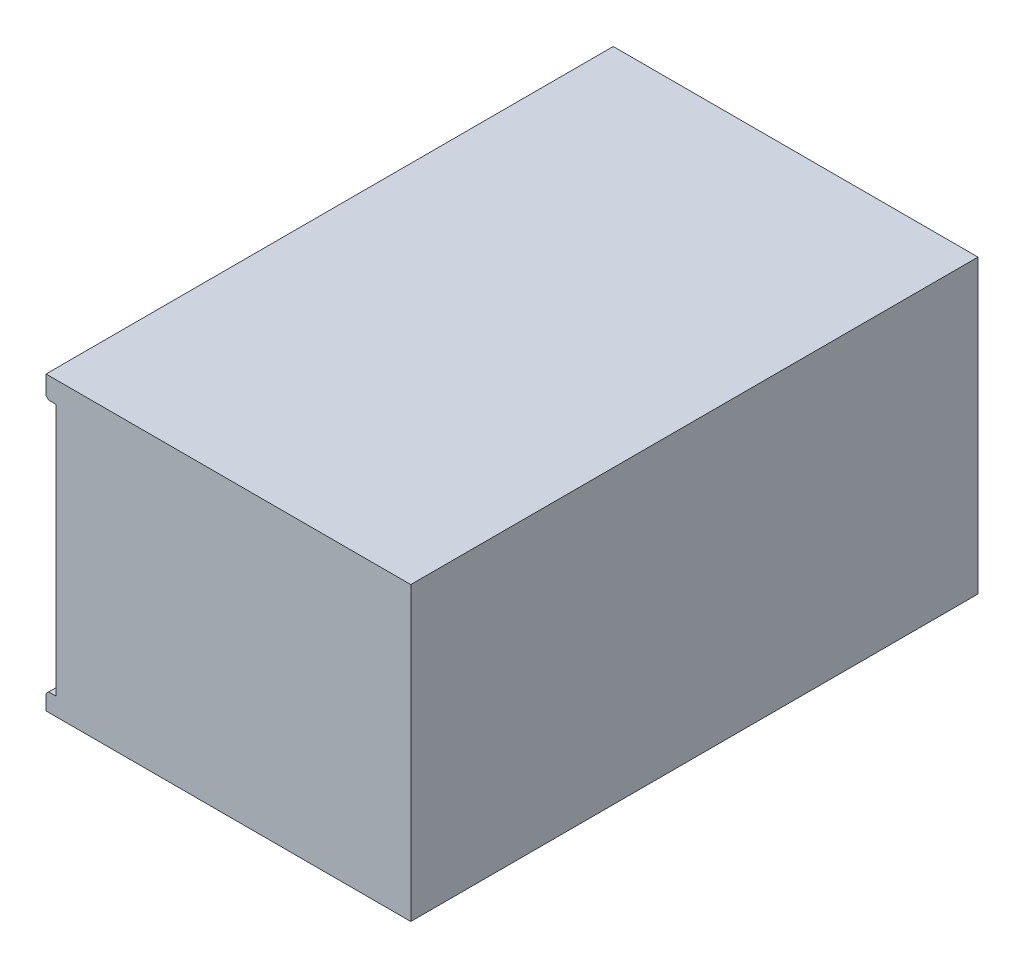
SolidWorks part; units mm, degrees
ref_plane "FRONT" through (0, 0, 0) normal (0, 0, 1) x (1, 0, 0)
ref_plane "TOP" through (0, 0, 0) normal (0, 1, 0) x (1, 0, 0)
ref_plane "RIGHT" through (0, 0, 0) normal (1, 0, 0) x (0, 0, -1)
sketch "Sketch1" plane through (0, 0, 0) normal (0, 0, 1) x (1, 0, 0)
  line L0 (50.673, 0) -> (50.673, -41.656)
  line L1 (50.673, -41.656) -> (-1.397, -41.656)
  line L2 (-1.397, -41.656) -> (-1.397, -39.116)
  line L3 (-1.397, -39.116) -> (0, -39.116)
  line L4 (0, -39.116) -> (0, -3.048)
  line L5 (0, -3.048) -> (-1.397, -3.048)
  line L6 (-1.397, -3.048) -> (-1.397, 0)
  line L7 (-1.397, 0) -> (50.673, 0)
  dimension "D1" = 52.07
  dimension "D2" = 50.673
  dimension "D3" = 3.048
  dimension "D4" = 2.54
  dimension "D5" = 41.656
extrude "Extrude1" add sketch "Sketch1" along normal mid plane 80.9752
sketch "Sketch2" plane through (0, 0, 0) normal (-1, 0, 0) x (0, 0, 1)
  line L0 (0, 0) -> (0, -41.656) construction
  line L1 (40.4876, -41.656) -> (-40.4876, -41.656) construction
  line L2 (0, -20.828) -> (44.6305, -20.828) construction
  point P0 (-35.179, -6.35)
  point P1 (35.179, -6.35)
  point P9 (-35.179, -35.814)
  point P15 (35.179, -35.814)
  dimension "D1" = 35.179
  dimension "D2" = 35.179
  dimension "D3" = 14.478
  dimension "D4" = 14.986
hole_wizard "#10-32 Tapped Hole1" positions "3DSketch1" profile "Sketch3" tap size "#10-32" standard "Ansi Inch"
sketch3d "3DSketch1"
  point P0 (0, -6.35, -35.179)
  point P3 (0, -6.35, 35.179)
  point P6 (0, -35.814, -35.179)
  point P9 (0, -35.814, 35.179)
sketch "Sketch3" plane through (0, -6.35, -35.179) normal (0, 1, 0) x (0, 0, 1)
  line L0 (0, 0) -> (0, 11.2108)
  line L1 (0, 11.2108) -> (2.0193, 9.9974)
  line L2 (2.0193, 9.9974) -> (2.0193, 7.62)
  line L3 (2.0193, 7.62) -> (2.413, 7.62)
  line L4 (2.413, 7.62) -> (2.413, 0)
  line L5 (2.413, 0) -> (0, 0)
  line L10 (0, 11.2108) -> (-2.0193, 9.9974) construction
  line L11 (0, -6.35) -> (0, 107.95) construction
  dimension "Tap Drill Dia." = 4.0386
  dimension "Tap Drill Depth" = 9.9974
  dimension "Thread Major Dia." = 4.826
  dimension "Thread Depth" = 7.62
  dimension "Drill Angle" = 118
chamfer "Chamfer1" distance 0.381 angle 45 2 edges at (-1.397, -39.116, 0) (-1.397, -3.048, 0)
